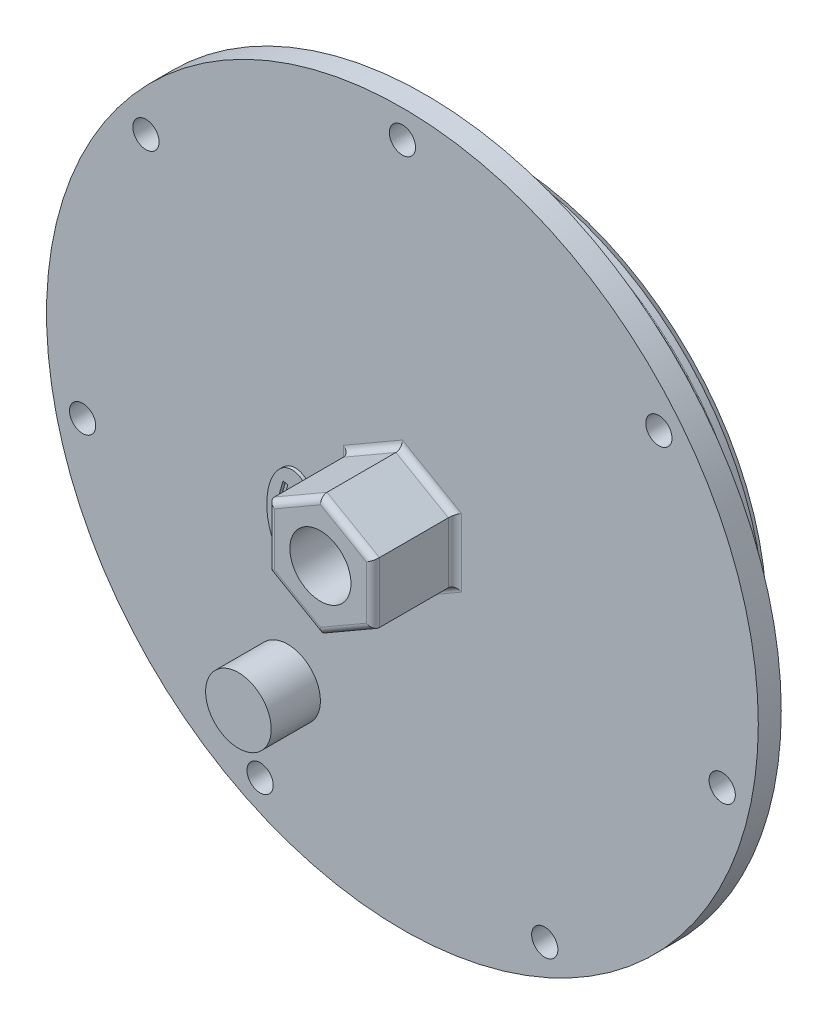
SolidWorks part; units mm, degrees
ref_plane "Face" through (0, 0, 0) normal (0, 0, 1) x (1, 0, 0)
ref_plane "Dessus" through (0, 0, 0) normal (0, 1, 0) x (1, 0, 0)
ref_plane "Côté" through (0, 0, 0) normal (1, 0, 0) x (0, 0, -1)
sketch "Esquisse2" plane through (0, 0, 0) normal (0, 0, 1) x (1, 0, 0)
  circle A0 centre (0, 0) radius 84.5
  dimension "D1" = 169
extrude "Base-extérieur" add sketch "Esquisse2" along normal blind 30
sketch "Esquisse17" plane through (0, 0, 30) normal (0, 0, 1) x (1, 0, 0)
  circle A0 centre (0, 0) radius 108.5
  dimension "D1" = 217
extrude "Recouvrement cuve" add sketch "Esquisse17" against normal blind 7
sketch "Esquisse3" plane through (0, 0, 30) normal (0, 0, 1) x (1, 0, 0)
  line L0 (0, 27.6257) -> (0, -29.9868) construction
  line L1 (0, 18.4752) -> (-16, 9.2376)
  line L2 (0, 18.4752) -> (16, 9.2376)
  line L3 (-16, 9.2376) -> (-16, -9.2376)
  line L4 (16, 9.2376) -> (16, -9.2376)
  line L5 (-16, -9.2376) -> (0, -18.4752)
  line L6 (16, -9.2376) -> (0, -18.4752)
  circle A0 centre (0, 0) radius 16 construction
  dimension "D1" = 32
extrude "6 pans" add sketch "Esquisse3" along normal blind 25
sketch "Esquisse4" plane through (0, 0, 0) normal (0, 0, -1) x (-1, 0, 0)
  circle A0 centre (0, 0) radius 70
  dimension "D1" = 140
extrude "Base intérieur" cut sketch "Esquisse4" against normal blind 20
chamfer "Chanfrein extérieur" distance 3.5 angle 60 1 edges at (84.5, 0, 0)
sketch "Esquisse18" plane through (0, 0, 30) normal (0, 0, 1) x (1, 0, 0)
  line L0 (0, 0) -> (-49.613, -85.9322) construction
  line L1 (0, 0) -> (-107.0078, 0) construction
  circle A0 centre (-35, -60.6218) radius 10
  dimension "D1" = 20
  dimension "D2" = 60
  dimension "D3" = 70
extrude "Bossage" add sketch "Esquisse18" along normal blind 15
fillet "R2 6 pans" radius 2 12 edges at (8, 13.8564, 30) (-8, 13.8564, 30) (-16, 0, 30) (-8, -13.8564, 30) (8, -13.8564, 30) (16, 0, 30) (8, 13.8564, 55) (-8, 13.8564, 55) (-16, 0, 55) (-8, -13.8564, 55) (8, -13.8564, 55) (16, 0, 55)
fillet "R2 interieur" radius 2 2 edges at (-70, 0, 20) (-70, 0, 0)
sketch "Esquisse16" plane through (-30.7914, -15.6166, 30) normal (0, 0, 1) x (0.2723, 0.9622, 0)
  line L1 (-3.856, 6.1192) -> (-5.2468, 5.5573)
  line L2 (-2.4462, 3.8772) -> (0.1545, -4.6294) construction
  line L3 (0.6265, -1.8979) -> (2.1265, -1.8979)
  line L4 (-3.856, 6.1192) -> (-0.625, -1.8778)
  line L5 (-6.7676, -4.3595) -> (-5.3768, -3.7976)
  line L6 (-6.7676, -4.3595) -> (-9.9986, 3.6374)
  line L7 (-0.625, -1.8778) -> (-2.7286, -2.7277)
  line L8 (-9.9986, 3.6374) -> (-2.5777, -1.0489)
  line L9 (-5.3768, -3.7976) -> (-6.8643, -0.1159)
  line L10 (-6.8643, -0.1159) -> (-2.7286, -2.7277)
  line L13 (-2.5777, -1.0489) -> (-5.2468, 5.5573)
  line L15 (0.6265, -1.8979) -> (0.6265, 6.7271)
  line L16 (0.6265, 6.7271) -> (6.8765, 6.7271)
  line L17 (6.8765, 5.2271) -> (6.8765, 6.7271)
  line L18 (6.8765, 5.2271) -> (2.1265, 5.2271)
  line L19 (2.1265, 5.2271) -> (2.1265, 3.3521)
  line L20 (2.1265, 3.3521) -> (5.7515, 3.3521)
  line L21 (2.1265, 1.8521) -> (5.7515, 1.8521)
  line L22 (5.7515, 3.3521) -> (5.7515, 1.8521)
  line L23 (2.1265, 1.8521) -> (2.1265, -1.8979)
  ellipse E0 centre (-0.625, 1.8521) end of major axis (11.7326, 5.2271) minor radius 7.6038
  dimension "D1" = 17
  dimension "D2" = 5
  dimension "D4" = 1.875
  dimension "D5" = 1.5
  dimension "D6" = 8.625
  dimension "D7" = 1.5
  dimension "D8" = 1.5
  dimension "D9" = 1.5
  dimension "D10" = 6.25
  dimension "D11" = 5.125
  dimension "D12" = 1.5
  dimension "D13" = 6.625
  dimension "D14" = 1.5
  dimension "D15" = 8.625
  dimension "D16" = 8.625
  dimension "D17" = 1.5
  dimension "D18" = 1.25
  dimension "D19" = 1.5
  dimension "D20" = 6.25
extrude "logo NF" add sketch "Esquisse16" along normal blind 1
sketch "Esquisse10" plane through (0, 0, 0) normal (0, 1, 0) x (1, 0, 0)
  line L0 (0, 7.7979) -> (0, -28.4056) construction
  line L1 (0, -23) -> (0, -6.0622) construction
  line L2 (82, 0) -> (82, -3.8)
  line L3 (72, 0) -> (-72, 0) construction
  line L4 (81.8, -4) -> (77, -4)
  line L5 (76.2, -4.8) -> (76.2, -12.2)
  line L6 (77, -13) -> (81.8, -13)
  line L7 (82, -13.2) -> (82, -23)
  line L8 (82, -23) -> (96.2, -23)
  line L9 (96.2, 0) -> (96.2, -23)
  line L10 (96.2, 0) -> (82, 0)
  arc A0 (77, -13) -> (76.2, -12.2) centre (77, -12.2) cw
  arc A1 (76.2, -4.8) -> (77, -4) centre (77, -4.8) cw
  arc A2 (82, -13.2) -> (81.8, -13) centre (81.8, -13.2) ccw
  arc A3 (81.8, -4) -> (82, -3.8) centre (81.8, -3.8) ccw
  dimension "D9" = 0.8
  dimension "D10" = 0.2
  dimension "D11" = 0.2
  dimension "D1" = 164
  dimension "D2" = 152.4
  dimension "D3" = 9
  dimension "D4" = 4
  dimension "D5" = 20
  dimension "D8" = 23
revolve "Usinage extérieur" cut sketch "Esquisse10" angle 360 about L0
other "Per/tar 1/2\""
sketch "Esquisse12" plane through (0, 0, 55) normal (0, 0, 1) x (1, 0, 0)
  circle A0 centre (0, 0) radius 9.315
  dimension "D1" = 18.63
sketch "Esquisse20" plane through (0, 0, 30) normal (0, 0, 1) x (1, 0, 0)
  circle A0 centre (0, 100) radius 4
  circle A1 centre (0, 0) radius 108.5 construction
  dimension "D1" = 8
  dimension "D2" = 100
extrude "Enlèv. mat.-Extru.2" cut sketch "Esquisse20" against normal blind 20
pattern_circular "Répétition circulaire2" count 7 over 360 about axis through (0, 0, 0) along (0, 0, 1) of "Enlèv. mat.-Extru.2"
